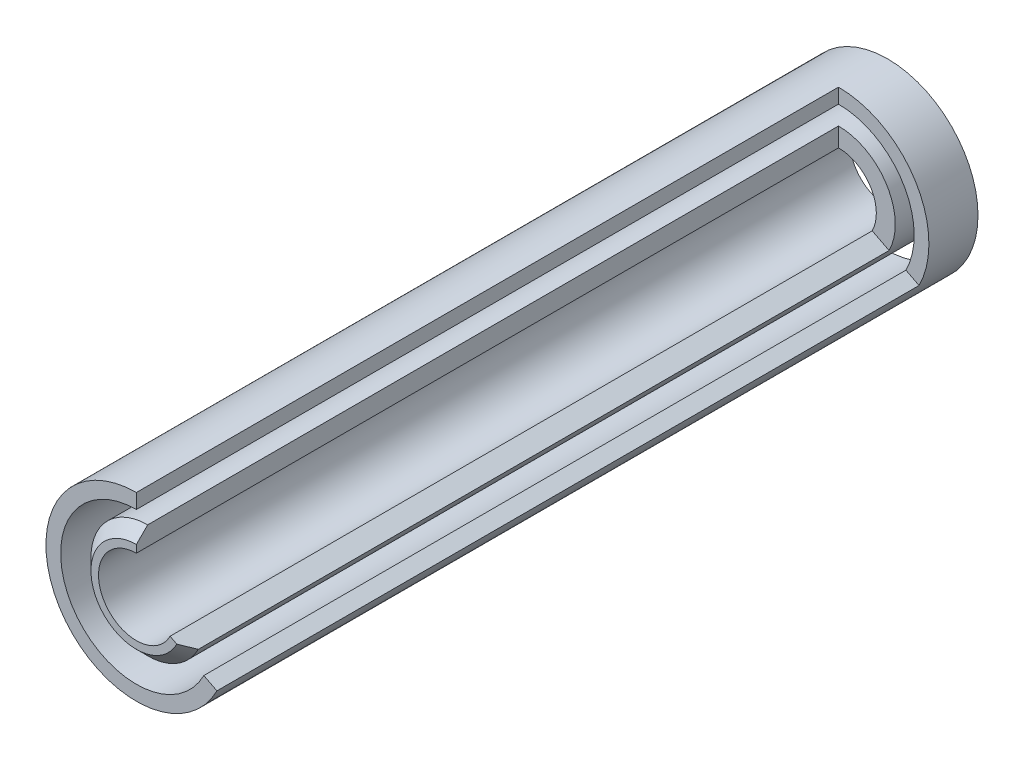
SolidWorks part; units mm, degrees
ref_plane "Přední rovina" through (0, 0, 0) normal (0, 0, 1) x (1, 0, 0)
ref_plane "Horní rovina" through (0, 0, 0) normal (0, 1, 0) x (1, 0, 0)
ref_plane "Pravá rovina" through (0, 0, 0) normal (1, 0, 0) x (0, 0, -1)
sketch "Skica5" plane through (0, 0, 0) normal (0, 0, 1) x (1, 0, 0)
  circle A0 centre (0, 0) radius 23.893
  circle A1 centre (0, 0) radius 20
  dimension "D1" = 47.786
  dimension "D2" = 40
extrude "Přidat vysunutím6" add sketch "Skica5" along normal blind 198.4962
sketch "Skica9" plane through (0, 0, 198.4962) normal (0, 0, 1) x (1, 0, 0)
  circle A0 centre (0, 0) radius 15
  circle A1 centre (0, 0) radius 10
  dimension "D1" = 30
  dimension "D2" = 20
extrude "Přidat vysunutím7" add sketch "Skica9" against normal blind 218.5 separate body
chamfer "Zkosení1" distance 3 angle 45 1 edges at (15, 0, 198.4962)
sketch "Skica10" plane through (0, 0, 198.4962) normal (0, 0, 1) x (1, 0, 0)
  line L0 (0, 0) -> (0, 32.9199)
  line L1 (0, 0) -> (29.3318, -14.9453)
  circle A0 centre (0, 0) radius 32.9199
  dimension "D1" = 117
scale "Měřítko1" bodies to scale 107 scale about origin uniform scaling yes scale factor 0.655
scale "Měřítko2" bodies to scale 114 scale about origin uniform scaling yes scale factor 0.655
extrude "Odebrat vysunutím1" cut sketch "Skica10" against normal blind 190 contours L0 L1 M4 | L1 L0 M4 M3 | L1 A0 L0 M3
sketch "Skica11" plane through (0, 0, 0) normal (0, 0, -1) x (-1, 0, 0)
  circle A0 centre (0, 0) radius 43.6157
extrude "Odebrat vysunutím2" cut sketch "Skica11" along normal through all
